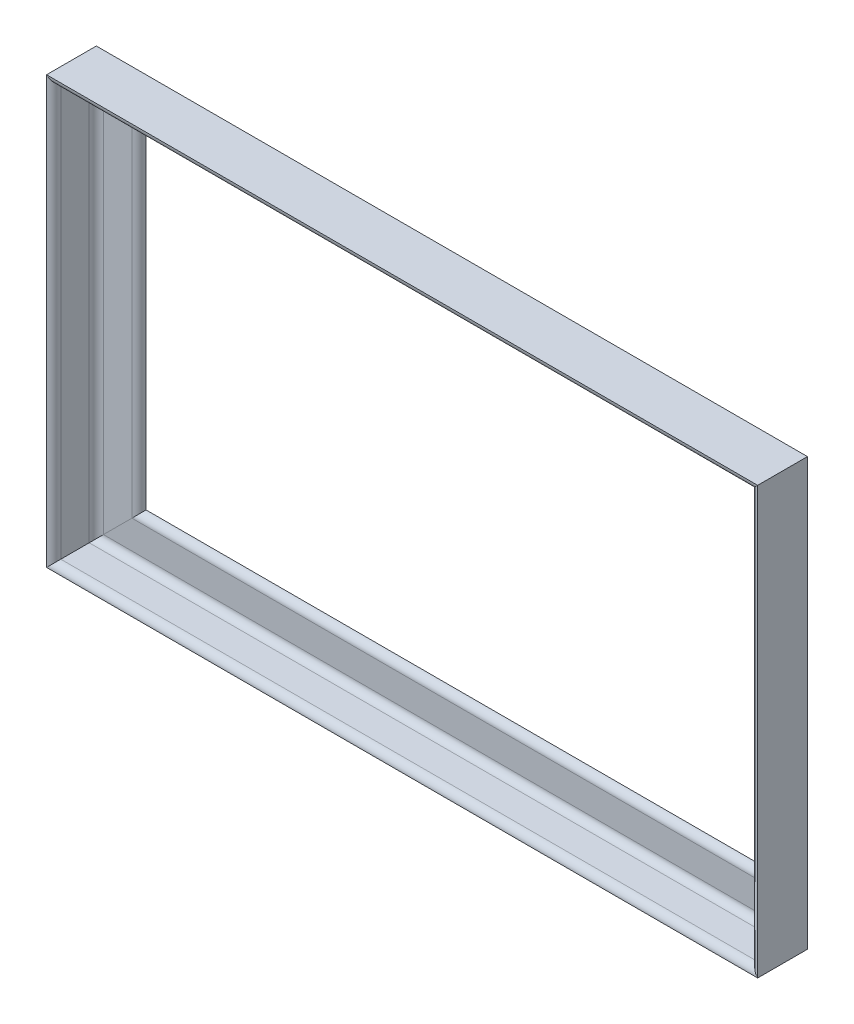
SolidWorks part; units mm, degrees
ref_plane "Płaszczyzna przednia" through (0, 0, 0) normal (0, 0, 1) x (1, 0, 0)
ref_plane "Płaszczyzna górna" through (0, 0, 0) normal (0, 1, 0) x (1, 0, 0)
ref_plane "Płaszczyzna prawa" through (0, 0, 0) normal (1, 0, 0) x (0, 0, -1)
sketch "Szkic1" plane through (0, 0, 0) normal (0, 0, 1) x (1, 0, 0)
  line L0 (0, 150) -> (0, -150)
  line L1 (250, -150) -> (-250, -150)
  line L2 (250, -150) -> (250, 150)
  line L3 (250, 150) -> (-250, 150)
  line L4 (-250, -150) -> (-250, 150)
  line L5 (250, -150) -> (-250, 150) construction
  line L6 (250, 150) -> (-250, -150) construction
  line L7 (-250, 0) -> (250, 0)
  point P0 (0, 0)
  dimension "D1" = 300
  dimension "D2" = 500
other "Kątownik stalowy 35 X 35 X 5(1)"
ref_plane "Płaszczyzna2" through (250, -150, 0) normal (1, 0, 0) x (0, 1, 0)
sketch "Sketch1" plane through (250, -150, 0) normal (1, 0, 0) x (0, 1, 0)
  line L0 (0, 0) -> (0, 35)
  line L1 (0, 17.5) -> (5, 17.5) construction
  line L2 (5, 30) -> (5, 10)
  line L3 (10, 5) -> (30, 5)
  line L4 (17.5, 5) -> (17.5, 0) construction
  line L5 (35, 0) -> (0, 0)
  arc A0 (35, 0) -> (30, 5) centre (30, 0) ccw
  arc A1 (0, 35) -> (5, 30) centre (0, 30) cw
  arc A2 (10, 5) -> (5, 10) centre (10, 10) cw
  point P10 (17.5, 0)
  point P14 (0, 17.5)
  point P15 (5, 17.5)
  point P16 (17.5, 5)
  point P17 (5, 35)
  point P18 (35, 5)
  point P21 (0, 0)
  dimension "D2" = 5
  dimension "D3" = 35
  dimension "Radius_1" = 5
  dimension "D1" = 5
